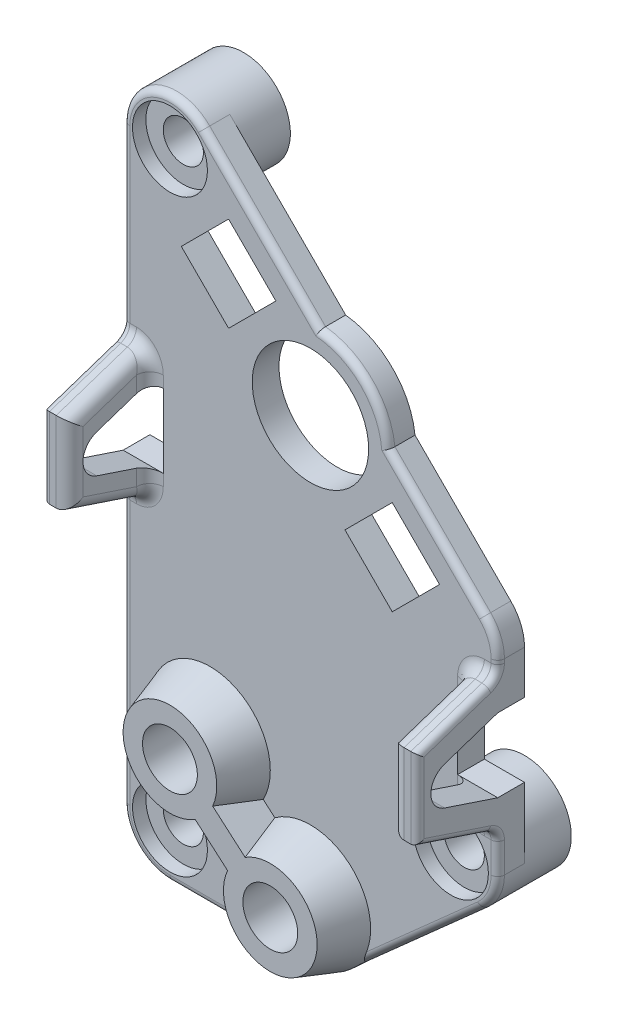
SolidWorks part; units mm, degrees
ref_plane "正面" through (0, 0, 0) normal (0, 0, 1) x (1, 0, 0)
ref_plane "平面" through (0, 0, 0) normal (0, 1, 0) x (1, 0, 0)
ref_plane "右側面" through (0, 0, 0) normal (1, 0, 0) x (0, 0, -1)
sketch "ｽｹｯﾁ1" plane through (0, 0, 0) normal (0, 0, 1) x (1, 0, 0)
  line L0 (-14, 43) -> (-14, -1)
  line L1 (-10.5, -4.5) -> (0, -4.5)
  line L2 (2.9905, -3.3626) -> (12.826, 5.3847)
  line L3 (14, 8) -> (14, 22)
  line L4 (12.9749, 24.4749) -> (5.8155, 31.6342)
  line L5 (0.6342, 36.8155) -> (-8.0251, 45.4749)
  line L6 (-7.8842, 38.8842) -> (7.8842, 23.1158) construction
  line L7 (-6.1165, 40.652) -> (-9.652, 37.1165)
  line L8 (-9.652, 37.1165) -> (-6.1165, 33.5809)
  line L9 (-6.1165, 33.5809) -> (-2.5809, 37.1165)
  line L10 (-2.5809, 37.1165) -> (-6.1165, 40.652)
  line L11 (6.1165, 28.4191) -> (2.5809, 24.8835)
  line L12 (2.5809, 24.8835) -> (6.1165, 21.348)
  line L13 (6.1165, 21.348) -> (9.652, 24.8835)
  line L14 (9.652, 24.8835) -> (6.1165, 28.4191)
  arc A0 (-8.0251, 45.4749) -> (-14, 43) centre (-10.5, 43) ccw
  arc A1 (0, -4.5) -> (2.9905, -3.3626) centre (0, 0) ccw
  arc A2 (12.826, 5.3847) -> (14, 8) centre (10.5, 8) ccw
  circle A3 centre (0, 31) radius 4.35
  arc A4 (5.8155, 31.6342) -> (0.6342, 36.8155) centre (0, 31) ccw
  arc A5 (14, 22) -> (12.9749, 24.4749) centre (10.5, 22) ccw
  arc A6 (-14, -1) -> (-10.5, -4.5) centre (-10.5, -1) ccw
  dimension "D1" = 9
  dimension "D2" = 7
  dimension "D3" = 7
  dimension "D4" = 11.7
  dimension "D5" = 8.7
  dimension "D18" = 3.5
  dimension "D6" = 31
  dimension "D7" = 14
  dimension "D8" = 14
  dimension "D9" = 45
  dimension "D10" = 8
  dimension "D11" = 43
  dimension "D12" = 5
  dimension "D13" = 5
  dimension "D14" = 5
  dimension "D15" = 5
  dimension "D16" = 6.15
  dimension "D17" = 6.15
extrude "押し出し1" add sketch "ｽｹｯﾁ1" along normal blind 2
sketch "ｽｹｯﾁ2" plane through (0, 0, 0) normal (0, 0, -1) x (-1, 0, 0)
  circle A0 centre (10.5, 43) radius 3.5
  circle A1 centre (10.5, -1) radius 3.5
  circle A2 centre (-10.5, 8) radius 3.5
  arc A3 (14, 43) -> (8.0251, 45.4749) centre (10.5, 43) ccw construction
  arc A4 (-14, 8) -> (-12.826, 5.3847) centre (-10.5, 8) ccw construction
  arc A5 (10.5, -4.5) -> (14, -1) centre (10.5, -1) ccw construction
extrude "押し出し2" add sketch "ｽｹｯﾁ2" along normal blind 3.5
sketch "ｽｹｯﾁ3" plane through (0, 0, -3.5) normal (0, 0, -1) x (-1, 0, 0)
  circle A0 centre (10.5, 43) radius 3
  circle A1 centre (-10.5, 8) radius 3
  circle A2 centre (10.5, -1) radius 3
  circle A3 centre (10.5, 43) radius 3.5 construction
  dimension "D1" = 6
  dimension "D2" = 6
  dimension "D3" = 6
extrude "ｶｯﾄ - 押し出し1" cut sketch "ｽｹｯﾁ3" against normal blind 0.5
sketch "ｽｹｯﾁ4" plane through (0, 0, 2) normal (0, 0, 1) x (1, 0, 0)
  circle A0 centre (0, 0) radius 4.5
  circle A1 centre (-7.5, 6.5) radius 4.5
  dimension "D1" = 9
  dimension "D2" = 9
  dimension "D3" = 6.5
  dimension "D4" = 7.5
extrude "押し出し4" add sketch "ｽｹｯﾁ4" along normal blind 3 draft 18.4
sketch "ｽｹｯﾁ5" plane through (0, 0, 5) normal (0, 0, 1) x (1, 0, 0)
  line L0 (0, 0) -> (-7.5, 6.5) construction
  line L1 (0.6549, 0.7557) -> (-6.8451, 7.2557)
  line L2 (-0.6549, -0.7557) -> (-8.1549, 5.7443)
  line L3 (-6.8451, 7.2557) -> (-8.1549, 5.7443)
  line L4 (0.6549, 0.7557) -> (-0.6549, -0.7557)
  dimension "D1" = 1
  dimension "D2" = 1
extrude "押し出し5" add sketch "ｽｹｯﾁ5" against normal up to surface (3 mm away)
sketch "ｽｹｯﾁ6" plane through (0, 0, 2) normal (0, 0, 1) x (1, 0, 0)
  circle A0 centre (-10.5, 43) radius 1.5
  circle A1 centre (-10.5, -1) radius 1.5
  circle A2 centre (10.5, 8) radius 1.5
  circle A3 centre (-7.5, 6.5) radius 2.05
  circle A4 centre (0, 0) radius 2.05
  dimension "D1" = 3
  dimension "D2" = 3
  dimension "D3" = 3
  dimension "D4" = 4.1
  dimension "D5" = 4.1
extrude "ｶｯﾄ - 押し出し2" cut sketch "ｽｹｯﾁ6" against normal through all and the other way through all
sketch "ｽｹｯﾁ7" plane through (14, 0, 0) normal (1, 0, 0) x (0, 0, -1)
  line L0 (-15.5982, 16) -> (13.1246, 16) construction
  line L1 (-5.9743, 17.423) -> (-2, 18.7478)
  line L2 (-2, 8) -> (-2, 22) construction
  line L3 (-2, 18.7478) -> (-2, 21)
  line L4 (-2, 21) -> (-8, 19)
  line L5 (-8, 19) -> (-8, 13)
  line L6 (-8, 13) -> (-2, 11)
  line L7 (-2, 11) -> (-2, 13.2522)
  line L8 (-2, 13.2522) -> (-5.9743, 14.577)
  arc A0 (-5.9743, 17.423) -> (-5.9743, 14.577) centre (-5.5, 16) ccw
  dimension "D8" = 1.5
  dimension "D1" = 16
  dimension "D2" = 5
  dimension "D3" = 5
  dimension "D4" = 3
  dimension "D5" = 3
  dimension "D6" = 3.5
  dimension "D7" = 6
extrude "押し出し6" add sketch "ｽｹｯﾁ7" against normal blind 2
sketch "ｽｹｯﾁ8" plane through (14, 0, 0) normal (1, 0, 0) x (0, 0, -1)
  line L0 (0, 8) -> (0, 22) construction
  line L1 (-2, 18.7478) -> (0, 18.7478)
  line L2 (-2, 18.7478) -> (-2, 13.2522)
  line L3 (-2, 13.2522) -> (0, 13.2522)
  line L4 (0, 18.7478) -> (0, 13.2522)
extrude "ｶｯﾄ - 押し出し3" cut sketch "ｽｹｯﾁ8" against normal blind 3
sketch "ｽｹｯﾁ9" plane through (-14, 0, 0) normal (-1, 0, 0) x (0, 0, 1)
  line L0 (-14.7403, 24.5) -> (22.8428, 24.5) construction
  line L1 (5.9743, 25.923) -> (2, 27.2478)
  line L2 (2, 43) -> (2, -1) construction
  line L3 (2, 27.2478) -> (2, 29.5)
  line L4 (2, 29.5) -> (8, 27.5)
  line L5 (8, 27.5) -> (8, 21.5)
  line L6 (8, 21.5) -> (2, 19.5)
  line L7 (2, 19.5) -> (2, 21.7522)
  line L8 (2, 21.7522) -> (5.9743, 23.077)
  arc A0 (5.9743, 25.923) -> (5.9743, 23.077) centre (5.5, 24.5) cw
  dimension "D8" = 1.5
  dimension "D1" = 24.5
  dimension "D2" = 3
  dimension "D3" = 3
  dimension "D4" = 5
  dimension "D5" = 5
  dimension "D6" = 6
  dimension "D7" = 3.5
extrude "押し出し7" add sketch "ｽｹｯﾁ9" against normal blind 2
sketch "ｽｹｯﾁ10" plane through (-14, 0, 0) normal (-1, 0, 0) x (0, 0, 1)
  line L0 (2, 27.2478) -> (2, 21.7522) construction
  line L1 (2, 21.7522) -> (0, 21.7522)
  line L2 (2, 21.7522) -> (2, 27.2478)
  line L3 (2, 27.2478) -> (0, 27.2478)
  line L4 (0, 21.7522) -> (0, 27.2478)
  line L5 (0, 43) -> (0, -1) construction
  line L6 (5.9743, 23.077) -> (2, 21.7522) construction
extrude "ｶｯﾄ - 押し出し4" cut sketch "ｽｹｯﾁ10" against normal blind 3
fillet "ﾌｨﾚｯﾄ1" radius 1 14 edges at (13, 11, 2) (13, 21, 2) (-13, 19.5, 2) (-13, 29.5, 2) (12, 12.1261, 2) (12, 12, 5) (12, 16, 8) (12, 20, 5) (12, 19.8739, 2) (-12, 20.6261, 2) (-12, 20.5, 5) (-12, 24.5, 8) (-12, 28.5, 5) (-12, 28.3739, 2)
sketch "ｽｹｯﾁ11" plane through (0, 0, 2) normal (0, 0, 1) x (1, 0, 0)
  circle A0 centre (-10.5, 43) radius 2.8
  circle A1 centre (-10.5, -1) radius 2.8
  circle A2 centre (10.5, 8) radius 2.8
  dimension "D1" = 5.6
  dimension "D2" = 5.6
  dimension "D3" = 5.6
extrude "ｶｯﾄ - 押し出し5" cut sketch "ｽｹｯﾁ11" against normal blind 1
fillet "ﾌｨﾚｯﾄ2" radius 0.5 24 edges at (-14, 20.614, 5.3419) (-14, 19.364, 2.1888) (-14, 8.8896, 2) (-12.9749, -3.4749, 2) (14, 12.114, 5.3419) (14, 10.864, 2.1888) (14, 9.1396, 2) (13.693, 6.5666, 2) (14, 19.886, 5.3419) (14, 21.136, 2.1888) (14, 21.8604, 2) (13.7336, 23.3394, 2) (-14, 28.386, 5.3419) (-14, 29.636, 2.1888) (-14, 36.6104, 2) (-11.8394, 46.2336, 2) (-14, 24.5, 8) (14, 16, 8) (9.3952, 28.0546, 2) (4.1366, 35.1366, 2) (-3.6954, 41.1452, 2)
